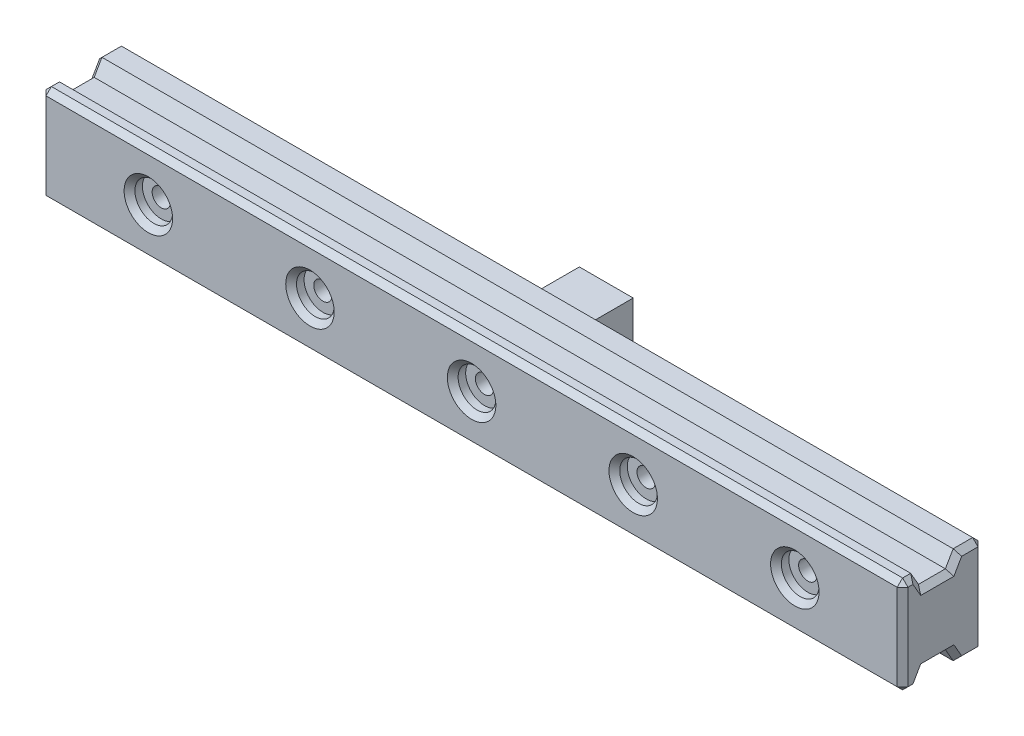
SolidWorks part; units mm, degrees
ref_plane "Front Plane" through (0, 0, 0) normal (0, 0, 1) x (1, 0, 0)
ref_plane "Top Plane" through (0, 0, 0) normal (0, 1, 0) x (1, 0, 0)
ref_plane "Right Plane" through (0, 0, 0) normal (1, 0, 0) x (0, 0, -1)
sketch "Sketch1" plane through (0, 0, 0) normal (0, 0, 1) x (1, 0, 0)
  line L1 (-80, -9) -> (80, -9)
  line L2 (-80, -9) -> (-80, 9)
  line L3 (-80, 9) -> (80, 9)
  line L4 (80, -9) -> (80, 9)
  line L5 (-80, -9) -> (80, 9) construction
  line L6 (-80, 9) -> (80, -9) construction
  point P0 (0, 0)
  dimension "D1" = 160
  dimension "D2" = 18
extrude "Boss-Extrude1" add sketch "Sketch1" along normal blind 15
sketch "Sketch2" plane through (80, 0, 0) normal (1, 0, 0) x (0, 0, -1)
  line L0 (-12.5, 9) -> (-4.6132, 9)
  line L1 (-15, 9) -> (0, 9) construction
  line L2 (-4.6132, 9) -> (-6.0566, 6.5)
  line L3 (-6.0566, 6.5) -> (-11.0566, 6.5)
  line L4 (-11.0566, 6.5) -> (-12.5, 9)
  line L5 (0, 0) -> (-15, 0) construction
  line L6 (0, -9) -> (0, 9) construction
  line L7 (-15, -9) -> (-15, 9) construction
  line L8 (-11.0566, -6.5) -> (-12.5, -9)
  line L9 (-6.0566, -6.5) -> (-11.0566, -6.5)
  line L10 (-4.6132, -9) -> (-6.0566, -6.5)
  line L11 (-12.5, -9) -> (-4.6132, -9)
  dimension "D1" = 2.5
  dimension "D2" = 2.5
  dimension "D3" = 60
  dimension "D4" = 5
extrude "Cut-Extrude1" cut sketch "Sketch2" against normal through all
sketch "Sketch3" plane through (0, 0, 0) normal (0, 0, -1) x (-1, 0, 0)
  line L1 (-5, -5) -> (5, -5)
  line L2 (-5, -5) -> (-5, 5)
  line L3 (-5, 5) -> (5, 5)
  line L4 (5, -5) -> (5, 5)
  line L5 (-5, -5) -> (5, 5) construction
  line L6 (-5, 5) -> (5, -5) construction
  point P0 (0, 0)
  dimension "D1" = 10
  dimension "D2" = 10
extrude "Boss-Extrude2" add sketch "Sketch3" along normal blind 10
hole_wizard "CBORE for M3 Pan Head Screw1" positions "3DSketch1" profile "Sketch4" counterbore size "M3" standard "ISO"
sketch3d "3DSketch1"
  point P0 (0, 0, 15)
sketch "Sketch4" plane through (0, 0, 15) normal (1, 0, 0) x (0, -1, 0)
  line L0 (0, 0) -> (0, 15.001)
  line L1 (0, 15.001) -> (1.7, 15.001)
  line L3 (1.7, 15.001) -> (1.7, 2.4)
  line L4 (1.7, 2.4) -> (3.5, 2.4)
  line L5 (3.5, 2.4) -> (3.5, 0)
  line L7 (3.5, 0) -> (0, 0)
  line L11 (0, -6.35) -> (0, 107.95) construction
  dimension "Thru Hole Dia." = 3.4
  dimension "Thru Hole Depth" = 15.001
  dimension "C'Bore Dia." = 7
  dimension "C'Bore Depth" = 2.4
chamfer "Chamfer1" distance 1 angle 45 29 edges at (3.5, 0, 15) (80, 7.75, 5.3349) (80, 9, 2.3066) (80, 0, 0) (80, -9, 2.3066) (80, -7.75, 5.3349) (80, -6.5, 8.5566) (80, -7.75, 11.7783) (80, -9, 13.75) (80, 0, 15) (80, 6.5, 8.5566) (80, 7.75, 11.7783) (80, 9, 13.75) (-80, 0, 15) (0, -9, 15) (-80, -9, 13.75) (-80, -7.75, 11.7783) (-80, -6.5, 8.5566) (-80, -7.75, 5.3349) (-80, -9, 2.3066) (0, -9, 0) (-80, 0, 0) (0, 9, 0) (-80, 9, 2.3066) (-80, 7.75, 5.3349) (-80, 6.5, 8.5566) (-80, 7.75, 11.7783) (-80, 9, 13.75) (0, 9, 15)
pattern_linear "LPattern2" count 3 spacing 30 along (1, 0, 0) of "CBORE for M3 Pan Head Screw1"
pattern_linear "LPattern3" count 3 spacing 30 along (-1, 0, 0) of "CBORE for M3 Pan Head Screw1"
chamfer "Chamfer2" distance 1 angle 45 4 edges at (63.5, 0, 15) (33.5, 0, 15) (-26.5, 0, 15) (-56.5, 0, 15)
